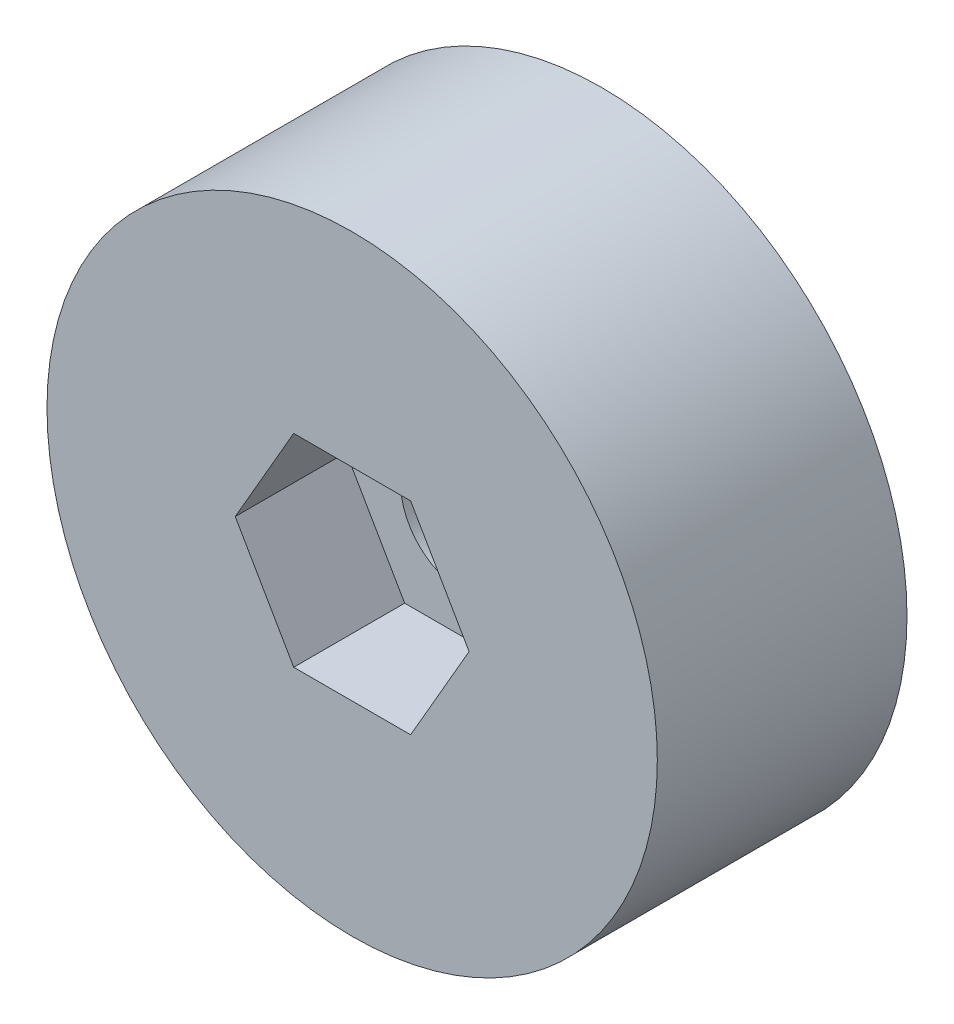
SolidWorks part; units mm, degrees
ref_plane "前视基准面" through (0, 0, 0) normal (0, 0, 1) x (1, 0, 0)
ref_plane "上视基准面" through (0, 0, 0) normal (0, 1, 0) x (1, 0, 0)
ref_plane "右视基准面" through (0, 0, 0) normal (1, 0, 0) x (0, 0, -1)
other "Configuration Table"
sketch "草图1" plane through (0, 0, 0) normal (0, 0, 1) x (1, 0, 0)
  circle A0 centre (0, 0) radius 11
  circle A1 centre (0, 0) radius 2.25
  dimension "D1" = 4.5
  dimension "D2" = 22
extrude "Knob_M4_through" add sketch "草图1" along normal blind 5
sketch "草图2" plane through (0, 0, 0) normal (0, 0, 1) x (1, 0, 0)
  line L0 (4.2147, 0) -> (2.1073, 3.65)
  line L1 (2.1073, 3.65) -> (-2.1073, 3.65)
  line L2 (-2.1073, 3.65) -> (-4.2147, 0)
  line L3 (-4.2147, 0) -> (-2.1073, -3.65)
  line L4 (-2.1073, -3.65) -> (2.1073, -3.65)
  line L5 (2.1073, -3.65) -> (4.2147, 0)
  circle A0 centre (0, 0) radius 11
  dimension "D1" = 22
  dimension "D2" = 2.1073
  dimension "D3" = 4.2147
  dimension "D4" = 2.1073
extrude "Hex_nut_pocket_AF7p3" add sketch "草图2" along normal blind 4 from offset 5
